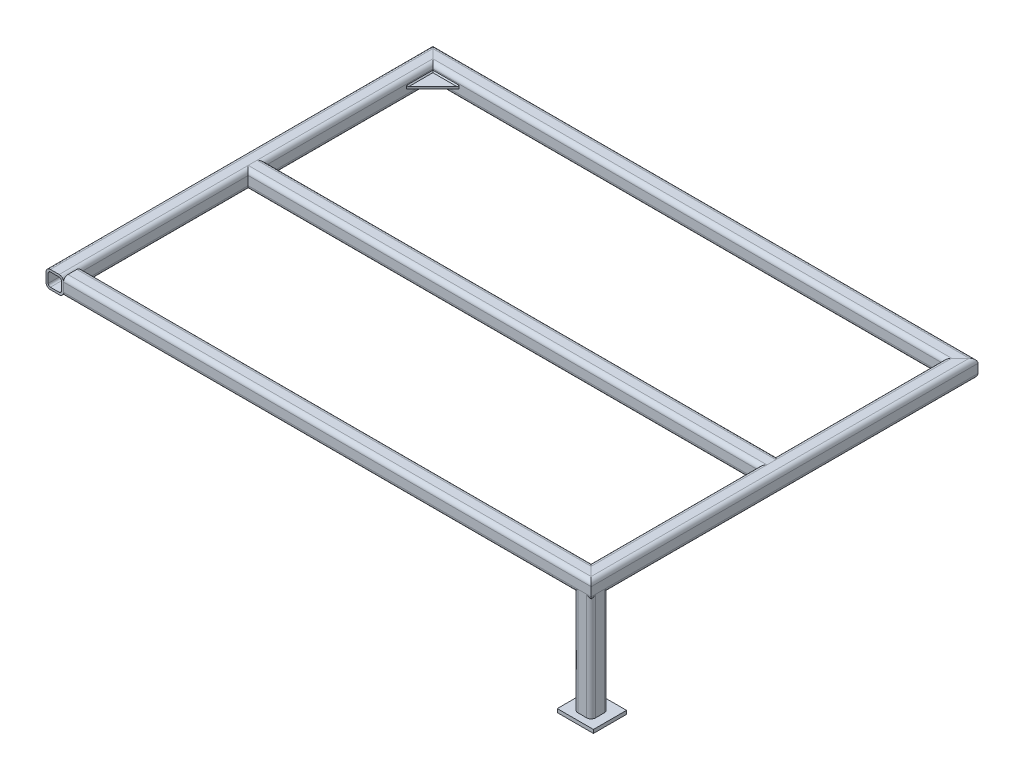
SolidWorks part; units mm, degrees
other "DetailItem1"
ref_plane "Front Plane" through (0, 0, 0) normal (0, 0, 1) x (1, 0, 0)
ref_plane "Top Plane" through (0, 0, 0) normal (0, 1, 0) x (1, 0, 0)
ref_plane "Right Plane" through (0, 0, 0) normal (1, 0, 0) x (0, 0, -1)
sketch "Sketch1" plane through (0, 0, 0) normal (0, 1, 0) x (1, 0, 0)
  line L0 (762, 533.4) -> (-762, -533.4) construction
  line L1 (-762, 533.4) -> (762, 533.4)
  line L2 (-762, 533.4) -> (-762, -533.4)
  line L3 (-762, -533.4) -> (762, -533.4)
  line L4 (762, 533.4) -> (762, -533.4)
  dimension "D1" = 1524
  dimension "D2" = 1066.8
sketch3d "3DSketch1"
  line L0 (-762, 0, 0) -> (762, 0, 0)
  line L1 (-762, 0, -533.4) -> (-762, 0, 533.4) construction
  line L2 (762, 0, -533.4) -> (762, 0, 533.4) construction
  line L4 (-762, 0, 533.4) -> (-762, -874.5136, 533.4)
  line L5 (762, 0, 533.4) -> (762, -321.9107, 533.4)
other "Structural Member1"
ref_plane "Plane2" through (-762, 0, 533.4) normal (1, 0, 0) x (0, 0, -1)
sketch "Sketch12" plane through (-762, 0, 533.4) normal (1, 0, 0) x (0, 0, -1)
  line L0 (-12.7, -19.05) -> (12.7, -19.05)
  line L1 (-19.05, -12.7) -> (-19.05, 12.7)
  line L2 (12.7, 19.05) -> (-12.7, 19.05)
  line L3 (19.05, 12.7) -> (19.05, -12.7)
  line L4 (-12.7, -25.4) -> (12.7, -25.4)
  line L5 (-25.4, -12.7) -> (-25.4, 12.7)
  line L6 (12.7, 25.4) -> (-12.7, 25.4)
  line L7 (25.4, 12.7) -> (25.4, -12.7)
  line L8 (0, 0) -> (19.05, 0) construction
  line L9 (0, 0) -> (0, 19.05) construction
  arc A0 (25.4, 12.7) -> (12.7, 25.4) centre (12.7, 12.7) ccw
  arc A1 (12.7, -25.4) -> (25.4, -12.7) centre (12.7, -12.7) ccw
  arc A2 (-25.4, -12.7) -> (-12.7, -25.4) centre (-12.7, -12.7) ccw
  arc A3 (-12.7, 25.4) -> (-25.4, 12.7) centre (-12.7, 12.7) ccw
  arc A4 (-12.7, 19.05) -> (-19.05, 12.7) centre (-12.7, 12.7) ccw
  arc A5 (19.05, 12.7) -> (12.7, 19.05) centre (12.7, 12.7) ccw
  arc A6 (12.7, -19.05) -> (19.05, -12.7) centre (12.7, -12.7) ccw
  arc A7 (-19.05, -12.7) -> (-12.7, -19.05) centre (-12.7, -12.7) ccw
  point P3 (0, 25.4)
  point P4 (25.4, 0)
  point P5 (0, -25.4)
  point P6 (-25.4, 0)
  point P7 (-25.4, 25.4)
  point P8 (-25.4, -25.4)
  point P33 (0, 0)
  point P35 (25.4, -25.4)
  point P36 (25.4, 25.4)
  point P37 (0, 0)
  dimension "D1" = 12.7
  dimension "Thickness" = 6.35
  dimension "V_leg" = 50.8
other "Trim/Extend1"
other "Structural Member2"
ref_plane "Plane3" through (762, 0, 533.4) normal (0, -1, 0) x (1, 0, 0)
sketch "Sketch13" plane through (762, 0, 533.4) normal (0, -1, 0) x (1, 0, 0)
  line L0 (-12.7, -19.05) -> (12.7, -19.05)
  line L1 (-19.05, -12.7) -> (-19.05, 12.7)
  line L2 (12.7, 19.05) -> (-12.7, 19.05)
  line L3 (19.05, 12.7) -> (19.05, -12.7)
  line L4 (-12.7, -25.4) -> (12.7, -25.4)
  line L5 (-25.4, -12.7) -> (-25.4, 12.7)
  line L6 (12.7, 25.4) -> (-12.7, 25.4)
  line L7 (25.4, 12.7) -> (25.4, -12.7)
  line L8 (0, 0) -> (19.05, 0) construction
  line L9 (0, 0) -> (0, 19.05) construction
  arc A0 (25.4, 12.7) -> (12.7, 25.4) centre (12.7, 12.7) ccw
  arc A1 (12.7, -25.4) -> (25.4, -12.7) centre (12.7, -12.7) ccw
  arc A2 (-25.4, -12.7) -> (-12.7, -25.4) centre (-12.7, -12.7) ccw
  arc A3 (-12.7, 25.4) -> (-25.4, 12.7) centre (-12.7, 12.7) ccw
  arc A4 (-12.7, 19.05) -> (-19.05, 12.7) centre (-12.7, 12.7) ccw
  arc A5 (19.05, 12.7) -> (12.7, 19.05) centre (12.7, 12.7) ccw
  arc A6 (12.7, -19.05) -> (19.05, -12.7) centre (12.7, -12.7) ccw
  arc A7 (-19.05, -12.7) -> (-12.7, -19.05) centre (-12.7, -12.7) ccw
  point P3 (0, 25.4)
  point P4 (25.4, 0)
  point P5 (0, -25.4)
  point P6 (-25.4, 0)
  point P7 (-25.4, 25.4)
  point P8 (-25.4, -25.4)
  point P33 (0, 0)
  point P35 (25.4, -25.4)
  point P36 (25.4, 25.4)
  point P37 (0, 0)
  dimension "D1" = 12.7
  dimension "Thickness" = 6.35
  dimension "V_leg" = 50.8
other "Trim/Extend2"
sketch "Sketch14" plane through (0, -321.9107, 0) normal (0, -1, 0) x (1, 0, 0)
  line L1 (813.2033, 578.0067) -> (708.7484, 578.0067)
  line L2 (813.2033, 578.0067) -> (813.2033, 482.3451)
  line L3 (813.2033, 482.3451) -> (708.7484, 482.3451)
  line L4 (708.7484, 578.0067) -> (708.7484, 482.3451)
extrude "Extrude1" add sketch "Sketch14" along normal blind 10.16 separate body
other "Gusset1" parameters "D1"=6.35, "D2"=6.35, "D3"=0, "D4"=0, "D10"=6.35, "D11"=76.2, "D12"=76.2, "D13"=12.7, "D14"=45, "D15"=12.7
sketch "Sketch15" plane through (-736.6, 0, -508) normal (0, 1, 0) x (-1, 0, 0)
  line L0 (0, 0) -> (0, 76.2)
  line L1 (0, 0) -> (-76.2, 0)
  line L2 (0, 76.2) -> (-76.2, 0)
other "Fillet Bead1" parameters "D10"=6.35, "D11"=3.175, "D12"=0, "D13"=3.175, "D14"=0
